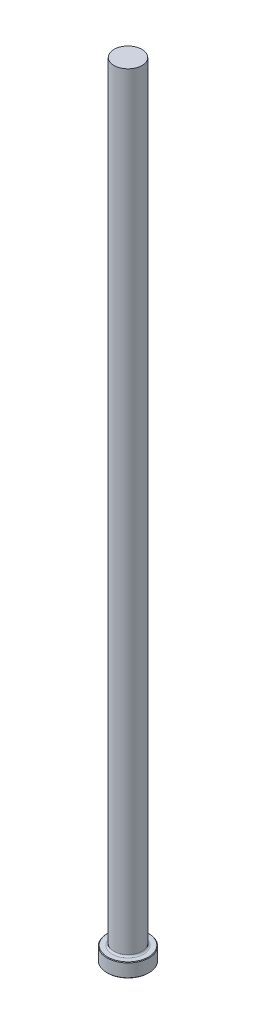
SolidWorks part; units mm, degrees
ref_plane "Front Plane" through (0, 0, 0) normal (0, 0, 1) x (1, 0, 0)
ref_plane "Top Plane" through (0, 0, 0) normal (0, 1, 0) x (1, 0, 0)
ref_plane "Right Plane" through (0, 0, 0) normal (1, 0, 0) x (0, 0, -1)
sketch "Sketch1" plane through (0, 0, 0) normal (0, 0, 1) x (1, 0, 0)
  line L0 (0, 259.9588) -> (0, -15.1925) construction
  line L1 (0, 0) -> (-9.525, 0)
  line L2 (-9.525, 0) -> (-9.525, 6.35)
  line L3 (-9.525, 6.35) -> (-6.35, 6.35)
  line L4 (-6.35, 6.35) -> (-6.35, 355.6)
  line L5 (-6.35, 355.6) -> (0, 355.6)
  line L6 (0, 355.6) -> (0, 0)
  dimension "L" = 355.6
  dimension "H" = 19.05
  dimension "T" = 6.35
  dimension "D" = 12.7
revolve "Revolve1" add sketch "Sketch1" angle 360 about L0
chamfer "Chamfer1" distance 0.254 angle 45 2 edges at (0, 6.35, 9.525) (0, 0, 9.525)
fillet "Fillet1" radius 0.762 1 edges at (0, 6.35, 6.35)
sketch "Pocket Sketch" plane through (0, 0, 0) normal (0, 0, 1) x (1, 0, 0)
  line L0 (-9.9219, 0) -> (-9.9219, 6.3754)
  line L1 (-9.9219, 6.3754) -> (-7.5089, 6.3754)
  line L2 (-6.7469, 7.1374) -> (-6.7469, 22.225)
  line L3 (-6.7469, 22.225) -> (0, 22.225)
  line L4 (0, 22.225) -> (0, 0)
  line L5 (0, 0) -> (-9.9219, 0)
  line L6 (0, 12.6104) -> (0, -2.4989) construction
  line L7 (-9.525, 6.096) -> (-9.525, 0.254) construction
  line L8 (9.271, 6.35) -> (-9.271, 6.35) construction
  line L9 (-6.35, 355.6) -> (-6.35, 7.112) construction
  line L10 (-7.5089, 6.3754) -> (-6.7469, 7.1374)
  point P3 (-6.7469, 6.3754)
  dimension "D1" = 19.8437
  dimension "D2" = 0.3969
  dimension "D3" = 0.0254
  dimension "D4" = 0.3969
  dimension "D5" = 13.4937
  dimension "D6" = 22.225
